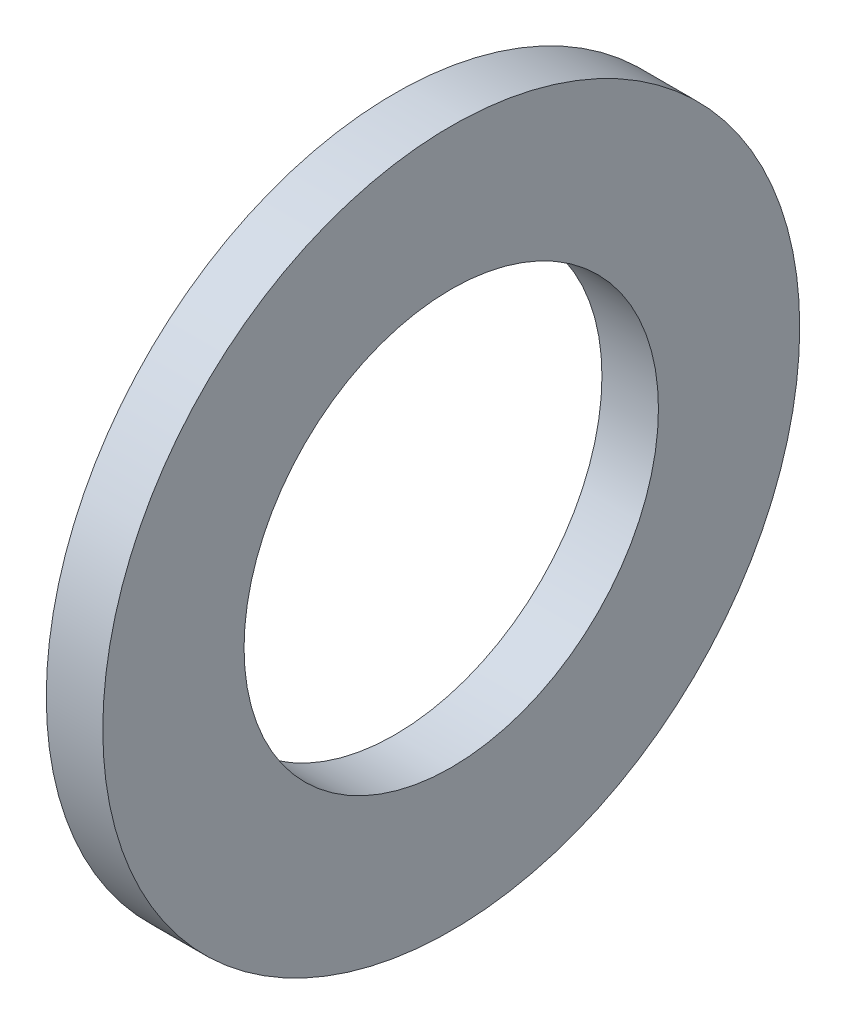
SolidWorks part; units mm, degrees
ref_plane "Plane1" through (0, 0, 0) normal (0, 0, 1) x (1, 0, 0)
ref_plane "Plane2" through (0, 0, 0) normal (0, 1, 0) x (1, 0, 0)
ref_plane "Plane3" through (0, 0, 0) normal (1, 0, 0) x (0, 0, -1)
sketch "Sketch1" plane through (0, 0, 0) normal (0, 0, 1) x (1, 0, 0)
  line L0 (-34.925, 0) -> (9.525, 0) construction
  line L1 (0, 11) -> (0, 18.5)
  line L2 (0, 18.5) -> (-3, 18.5)
  line L3 (-3, 18.5) -> (-3, 11)
  line L4 (-3, 11) -> (0, 11)
  dimension "Thickness" = 3
  dimension "Inside_dia" = 22
  dimension "Outside_dia" = 37
revolve "Base-Revolve" add sketch "Sketch1" angle 360 about L0
